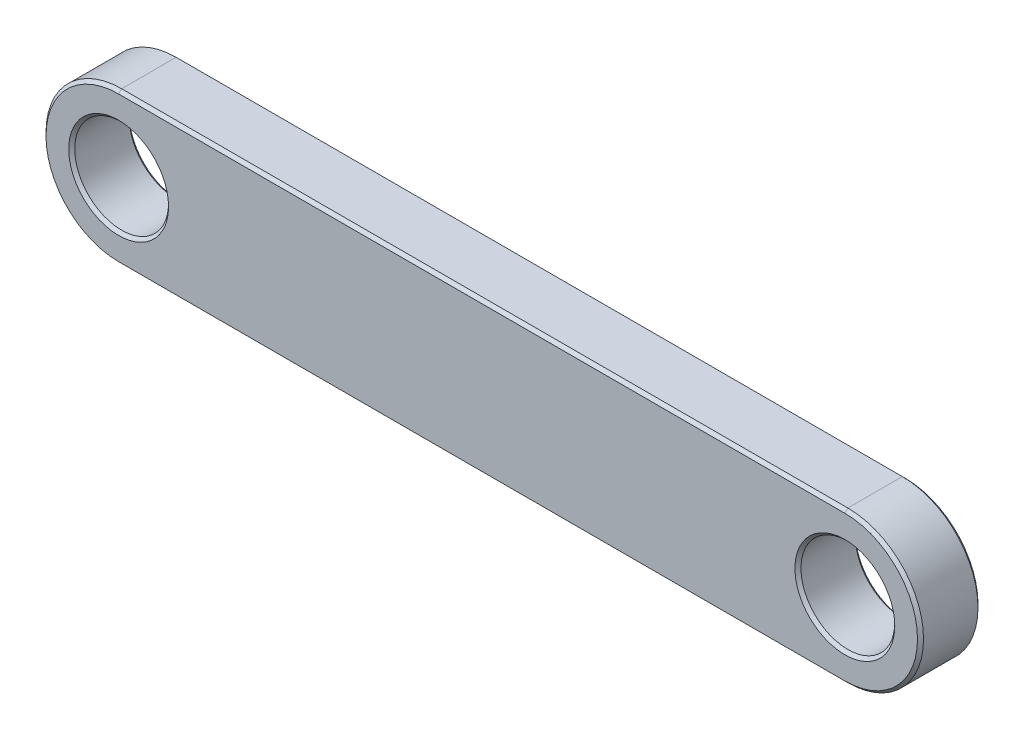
SolidWorks part; units mm, degrees
ref_plane "Front Plane" through (0, 0, 0) normal (0, 0, 1) x (1, 0, 0)
ref_plane "Top Plane" through (0, 0, 0) normal (0, 1, 0) x (1, 0, 0)
ref_plane "Right Plane" through (0, 0, 0) normal (1, 0, 0) x (0, 0, -1)
sketch "Sketch1" plane through (0, 0, 0) normal (0, 0, 1) x (1, 0, 0)
  line L0 (12, 0) -> (-12, 0) construction
  line L1 (12, -2.5) -> (-12, -2.5)
  line L2 (12, 2.5) -> (-12, 2.5)
  arc A0 (12, -2.5) -> (12, 2.5) centre (12, 0) ccw
  arc A1 (-12, 2.5) -> (-12, -2.5) centre (-12, 0) ccw
  circle A2 centre (-12, 0) radius 1.55
  circle A3 centre (12, 0) radius 1.55
  point P2 (0, 0)
  dimension "D3" = 3.1
  dimension "D4" = 3.1
  dimension "D2" = 2.5
  dimension "D1" = 24
extrude "Boss-Extrude1" add sketch "Sketch1" along normal blind 2
chamfer "Chamfer1" distance 0.1 angle 45 12 edges at (13.55, 0, 0) (-10.45, 0, 0) (0, 2.5, 0) (-14.5, 0, 0) (0, -2.5, 0) (14.5, 0, 0) (13.55, 0, 2) (0, -2.5, 2) (-14.5, 0, 2) (0, 2.5, 2) (14.5, 0, 2) (-10.45, 0, 2)
